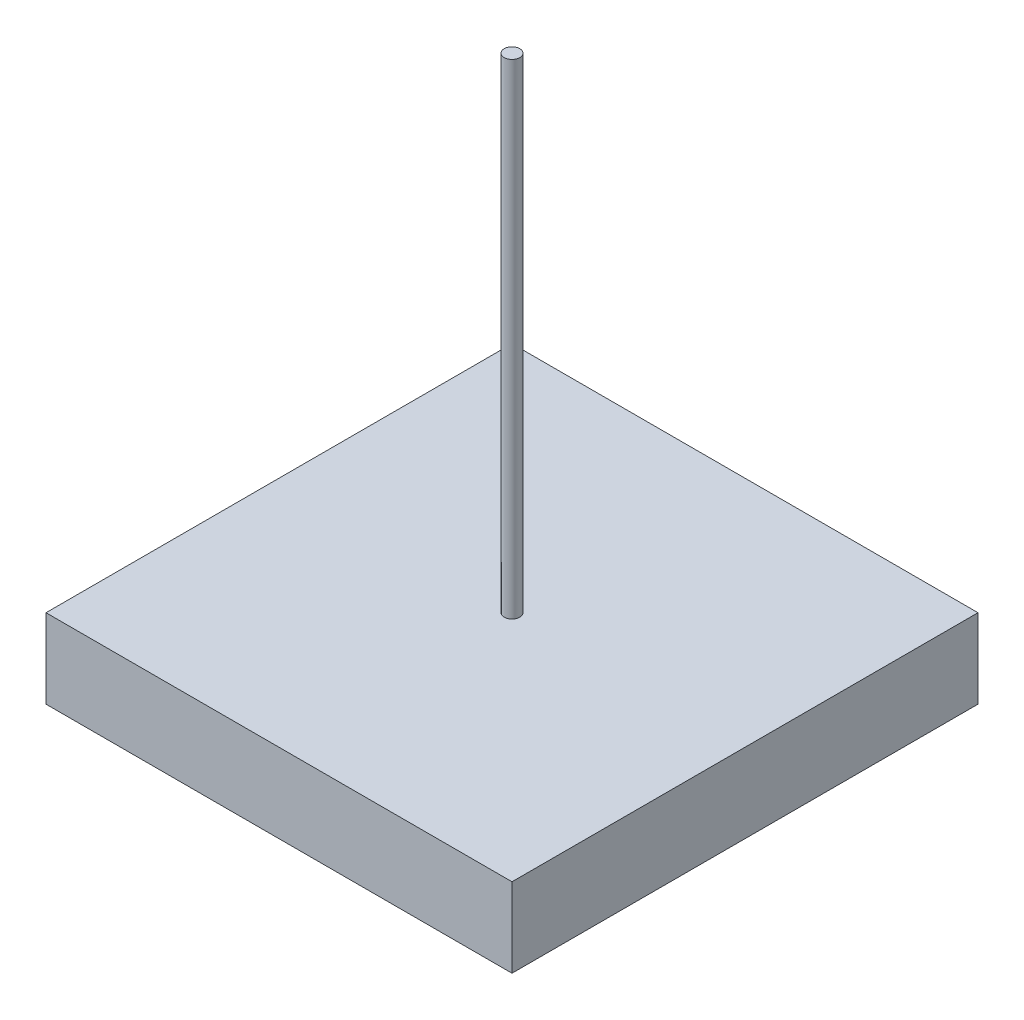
SolidWorks part; units mm, degrees
ref_plane "Ebene vorne" through (0, 0, 0) normal (0, 0, 1) x (1, 0, 0)
ref_plane "Ebene oben" through (0, 0, 0) normal (0, 1, 0) x (1, 0, 0)
ref_plane "Ebene rechts" through (0, 0, 0) normal (1, 0, 0) x (0, 0, -1)
sketch "Skizze1" plane through (0, 0, 0) normal (0, 1, 0) x (1, 0, 0)
  line L1 (-150, -150) -> (150, -150)
  line L2 (-150, -150) -> (-150, 150)
  line L3 (-150, 150) -> (150, 150)
  line L4 (150, -150) -> (150, 150)
  dimension "D1" = 300
  dimension "D2" = 300
  dimension "D3" = 150
  dimension "D4" = 150
extrude "Aufsatz-Linear austragen1" add sketch "Skizze1" along normal blind 3 contours L3 L4 L1 L2
sketch "Skizze2" plane through (0, 3, 0) normal (0, 1, 0) x (1, 0, 0)
  line L0 (-150, -150) -> (-150, 150) construction
  line L1 (-147, 147) -> (147, 147)
  line L2 (-147, 147) -> (-147, -147)
  line L3 (-147, -147) -> (147, -147)
  line L4 (147, 147) -> (147, -147)
  line L5 (-150, -150) -> (150, -150) construction
  line L6 (150, -150) -> (150, 150) construction
  line L7 (-150, 150) -> (150, 150) construction
  line L9 (-150, 150) -> (150, 150)
  line L10 (-150, 150) -> (-150, -150)
  line L11 (-150, -150) -> (150, -150)
  line L12 (150, 150) -> (150, -150)
  dimension "D1" = 3
  dimension "D2" = 3
  dimension "D3" = 3
  dimension "D4" = 3
extrude "Aufsatz-Linear austragen2" add sketch "Skizze2" along normal blind 45
sketch "Skizze3" plane through (0, 3, 0) normal (0, 1, 0) x (1, 0, 0)
  circle A0 centre (0, 0) radius 5
  dimension "D1" = 10
extrude "Aufsatz-Linear austragen3" add sketch "Skizze3" along normal blind 360
sketch "Skizze5" plane through (0, 48, 0) normal (0, 1, 0) x (1, 0, 0)
  line L1 (-150, 150) -> (150, 150)
  line L2 (-150, 150) -> (-150, -150)
  line L3 (-150, -150) -> (150, -150)
  line L4 (150, 150) -> (150, -150)
extrude "Aufsatz-Linear austragen4" add sketch "Skizze5" along normal blind 3
